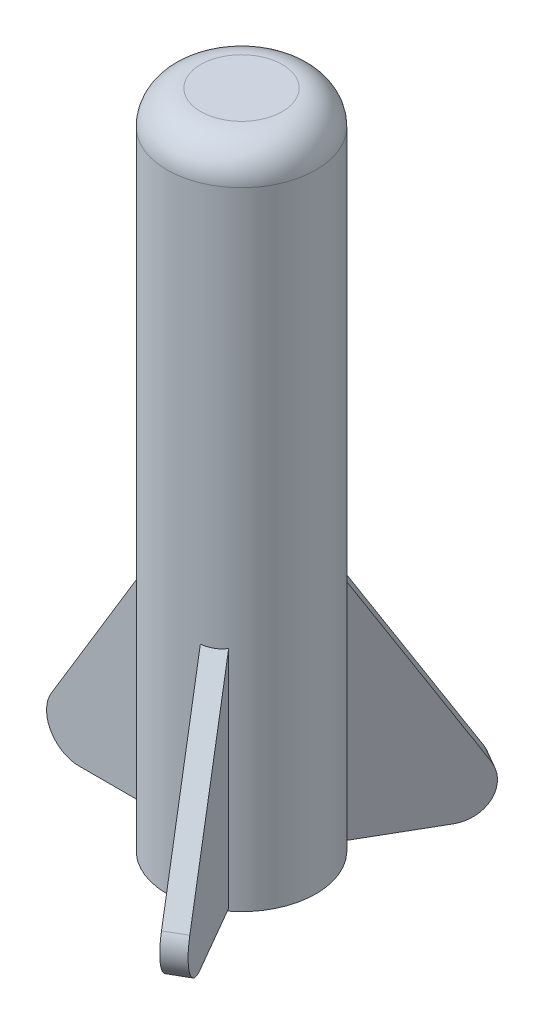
SolidWorks part; units mm, degrees
ref_plane "Front" through (0, 0, 0) normal (0, 0, 1) x (1, 0, 0)
ref_plane "Top" through (0, 0, 0) normal (0, 1, 0) x (1, 0, 0)
ref_plane "Right" through (0, 0, 0) normal (1, 0, 0) x (0, 0, -1)
sketch "Sketch1" plane through (0, 0, 0) normal (0, 1, 0) x (1, 0, 0)
  circle A0 centre (0, 0) radius 7.3025
  dimension "D1" = 14.605
extrude "Base-Extrude" add sketch "Sketch1" along normal blind 64.77
fillet "Fillet1" radius 3.302 1 edges at (0, 64.77, 7.3025)
sketch "Sketch2" plane through (0, 0, 0) normal (0, -1, 0) x (1, 0, 0)
  circle A0 centre (0, 0) radius 2.794
  dimension "D1" = 5.588
extrude "Cut-Extrude1" cut sketch "Sketch2" against normal blind 34.29
sketch "Sketch3" plane through (0, 0, 0) normal (0, 0, 1) x (1, 0, 0)
  line L0 (-7.0485, 0.254) -> (-14.9225, 0.254)
  line L1 (-17.6402, 5.0705) -> (-7.0485, 22.606)
  line L2 (-7.0485, 22.606) -> (-7.0485, 0.254)
  line L3 (-7.3025, 61.468) -> (-7.3025, 0) construction
  line L4 (7.3025, 0) -> (-7.3025, 0) construction
  arc A0 (-14.9225, 0.254) -> (-17.6402, 5.0705) centre (-14.9225, 3.429) cw
  dimension "D2" = 3.175
  dimension "D1" = 0.254
  dimension "D3" = 0.254
  dimension "D4" = 22.352
  dimension "D5" = 7.62
extrude "Boss-Extrude1" add sketch "Sketch3" along normal mid plane 2.032
pattern_circular "CirPattern1" count 3 over 360 about axis through (0, 0, 0) along (0, 1, 0) of "Boss-Extrude1"
